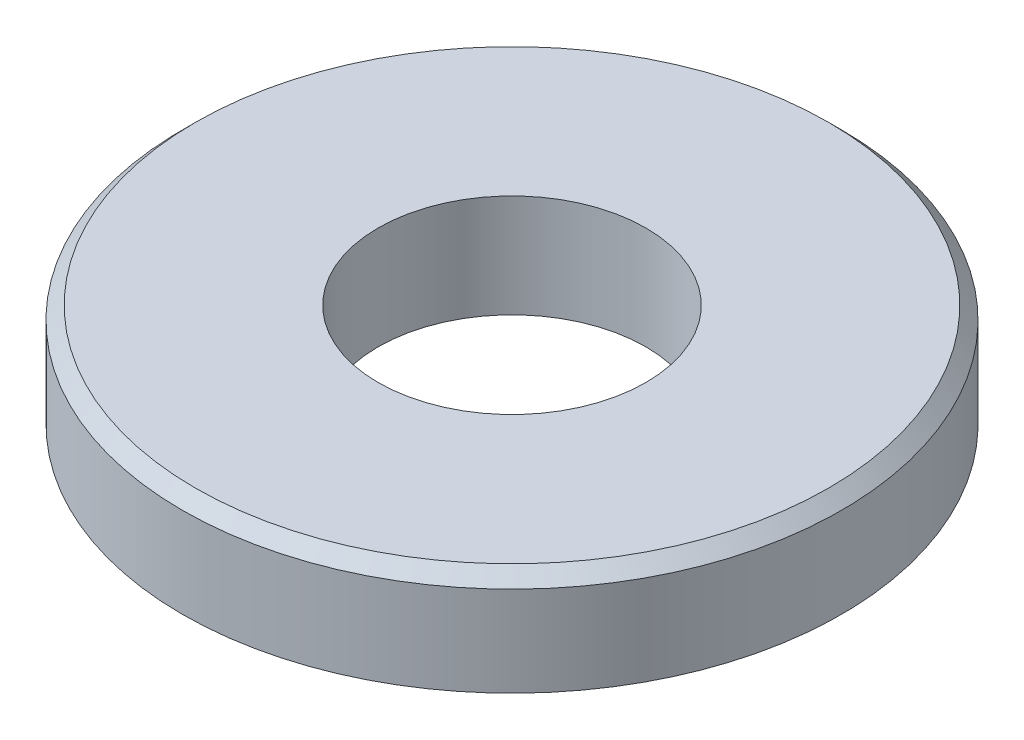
SolidWorks part; units mm, degrees
ref_plane "Face" through (0, 0, 0) normal (0, 0, 1) x (1, 0, 0)
ref_plane "Dessus" through (0, 0, 0) normal (0, 1, 0) x (1, 0, 0)
ref_plane "Droite" through (0, 0, 0) normal (1, 0, 0) x (0, 0, -1)
sketch "Esquisse1" plane through (0, 0, 0) normal (0, 1, 0) x (1, 0, 0)
  circle A0 centre (0, 0) radius 16
  circle A1 centre (0, 0) radius 6.5
  dimension "D1" = 32
  dimension "D2" = 13
extrude "Base-Extrusion" add sketch "Esquisse1" along normal blind 5
chamfer "Chanfrein3" distance 0.625 angle 45 1 edges at (0, 5, 16)
equation "\"Ch@Chanfrein3\" = \"e@Base-Extrusion\" / 8"
